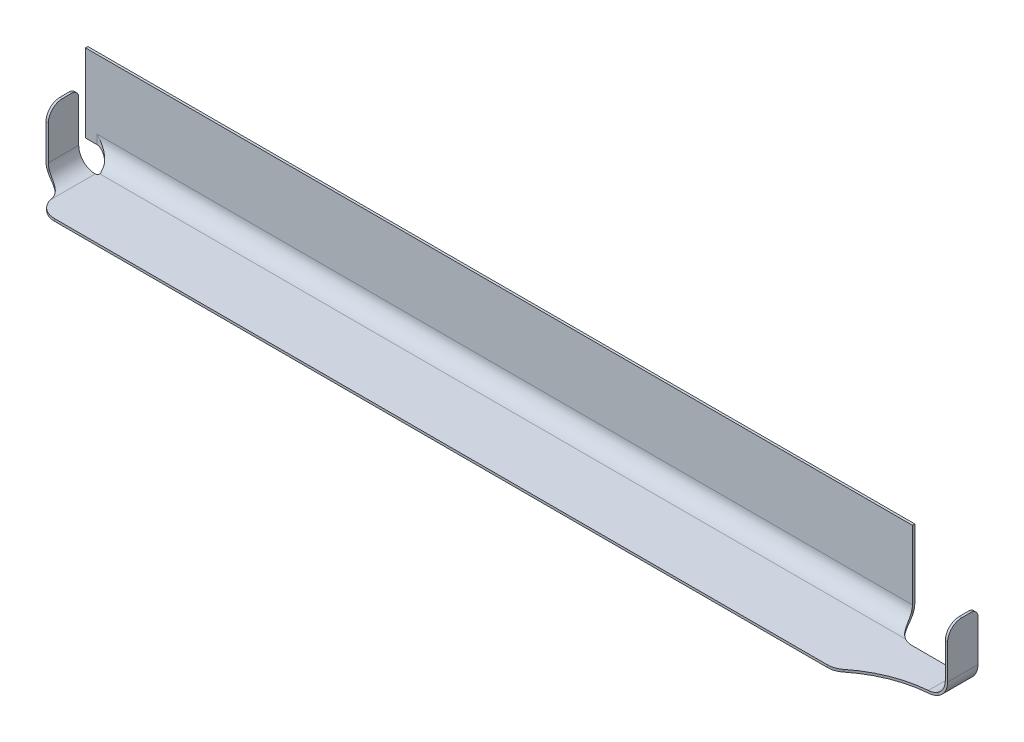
SolidWorks part; units mm, degrees
ref_plane "Front Plane" through (0, 0, 0) normal (1, 0, 0) x (0, 1, 0)
ref_plane "Top Plane" through (0, 0, 0) normal (0, 0, 1) x (0, 1, 0)
ref_plane "Right Plane" through (0, 0, 0) normal (0, 1, 0) x (-1, 0, 0)
sketch "sk 5dia hole pat" plane through (0, 0, 0) normal (0, 0, 1) x (0, 1, 0)
  line L4 (-30.48, -48.26) -> (30.48, -48.26) construction
  point P3 (0, -48.26)
  circle B0 centre (30.48, -579.12) radius 4.826
  circle B1 centre (1188.72, 579.12) radius 4.826
  circle B2 centre (78.74, -579.12) radius 4.826
  circle B3 centre (127, -579.12) radius 4.826
  circle B4 centre (175.26, -579.12) radius 4.826
  circle B5 centre (223.52, -579.12) radius 4.826
  circle B6 centre (271.78, -579.12) radius 4.826
  circle B7 centre (320.04, -579.12) radius 4.826
  circle B8 centre (368.3, -579.12) radius 4.826
  circle B9 centre (416.56, -579.12) radius 4.826
  circle B10 centre (464.82, -579.12) radius 4.826
  circle B11 centre (513.08, -579.12) radius 4.826
  circle B12 centre (561.34, -579.12) radius 4.826
  circle B13 centre (609.6, -579.12) radius 4.826
  circle B14 centre (657.86, -579.12) radius 4.826
  circle B15 centre (706.12, -579.12) radius 4.826
  circle B16 centre (754.38, -579.12) radius 4.826
  circle B17 centre (802.64, -579.12) radius 4.826
  circle B18 centre (850.9, -579.12) radius 4.826
  circle B19 centre (899.16, -579.12) radius 4.826
  circle B20 centre (947.42, -579.12) radius 4.826
  circle B21 centre (995.68, -579.12) radius 4.826
  circle B22 centre (1043.94, -579.12) radius 4.826
  circle B23 centre (1092.2, -579.12) radius 4.826
  circle B24 centre (1140.46, -579.12) radius 4.826
  circle B25 centre (1188.72, -579.12) radius 4.826
  circle B26 centre (30.48, -530.86) radius 4.826
  circle B27 centre (30.48, -482.6) radius 4.826
  circle B28 centre (30.48, -434.34) radius 4.826
  circle B29 centre (30.48, -386.08) radius 4.826
  circle B30 centre (30.48, -337.82) radius 4.826
  circle B31 centre (30.48, -289.56) radius 4.826
  circle B32 centre (30.48, -241.3) radius 4.826
  circle B33 centre (30.48, -193.04) radius 4.826
  circle B34 centre (30.48, -144.78) radius 4.826
  circle B35 centre (30.48, -96.52) radius 4.826
  circle B36 centre (30.48, -48.26) radius 4.826
  circle B37 centre (30.48, 0) radius 4.826
  circle B38 centre (30.48, 48.26) radius 4.826
  circle B39 centre (30.48, 96.52) radius 4.826
  circle B40 centre (30.48, 144.78) radius 4.826
  circle B41 centre (30.48, 193.04) radius 4.826
  circle B42 centre (30.48, 241.3) radius 4.826
  circle B43 centre (30.48, 289.56) radius 4.826
  circle B44 centre (30.48, 337.82) radius 4.826
  circle B45 centre (30.48, 386.08) radius 4.826
  circle B46 centre (30.48, 434.34) radius 4.826
  circle B47 centre (30.48, 482.6) radius 4.826
  circle B48 centre (30.48, 530.86) radius 4.826
  circle B49 centre (30.48, 579.12) radius 4.826
  circle B50 centre (1140.46, 579.12) radius 4.826
  circle B51 centre (1092.2, 579.12) radius 4.826
  circle B52 centre (1043.94, 579.12) radius 4.826
  circle B53 centre (995.68, 579.12) radius 4.826
  circle B54 centre (947.42, 579.12) radius 4.826
  circle B55 centre (899.16, 579.12) radius 4.826
  circle B56 centre (850.9, 579.12) radius 4.826
  circle B57 centre (802.64, 579.12) radius 4.826
  circle B58 centre (754.38, 579.12) radius 4.826
  circle B59 centre (706.12, 579.12) radius 4.826
  circle B60 centre (657.86, 579.12) radius 4.826
  circle B61 centre (609.6, 579.12) radius 4.826
  circle B62 centre (561.34, 579.12) radius 4.826
  circle B63 centre (513.08, 579.12) radius 4.826
  circle B64 centre (464.82, 579.12) radius 4.826
  circle B65 centre (416.56, 579.12) radius 4.826
  circle B66 centre (368.3, 579.12) radius 4.826
  circle B67 centre (320.04, 579.12) radius 4.826
  circle B68 centre (271.78, 579.12) radius 4.826
  circle B69 centre (223.52, 579.12) radius 4.826
  circle B70 centre (175.26, 579.12) radius 4.826
  circle B71 centre (127, 579.12) radius 4.826
  circle B72 centre (78.74, 579.12) radius 4.826
  circle B73 centre (1188.72, 530.86) radius 4.826
  circle B74 centre (1188.72, 482.6) radius 4.826
  circle B75 centre (1188.72, 434.34) radius 4.826
  circle B76 centre (1188.72, 386.08) radius 4.826
  circle B77 centre (1188.72, 337.82) radius 4.826
  circle B78 centre (1188.72, 289.56) radius 4.826
  circle B79 centre (1188.72, 241.3) radius 4.826
  circle B80 centre (1188.72, 193.04) radius 4.826
  circle B81 centre (1188.72, 144.78) radius 4.826
  circle B82 centre (1188.72, 96.52) radius 4.826
  circle B83 centre (1188.72, 48.26) radius 4.826
  circle B84 centre (1188.72, 0) radius 4.826
  circle B85 centre (1188.72, -48.26) radius 4.826
  circle B86 centre (1188.72, -96.52) radius 4.826
  circle B87 centre (1188.72, -144.78) radius 4.826
  circle B88 centre (1188.72, -193.04) radius 4.826
  circle B89 centre (1188.72, -241.3) radius 4.826
  circle B90 centre (1188.72, -289.56) radius 4.826
  circle B91 centre (1188.72, -337.82) radius 4.826
  circle B92 centre (1188.72, -386.08) radius 4.826
  circle B93 centre (1188.72, -434.34) radius 4.826
  circle B94 centre (1188.72, -482.6) radius 4.826
  circle B95 centre (1188.72, -530.86) radius 4.826
  line B96 (609.6, -579.12) -> (609.6, -504.12) construction
  line B97 (30.48, 0) -> (105.48, 0) construction
  circle B98 centre (-30.48, 579.12) radius 4.826
  circle B99 centre (-175.26, -579.12) radius 4.826
  circle B100 centre (-30.48, -579.12) radius 4.826
  circle B101 centre (-78.74, 579.12) radius 4.826
  circle B102 centre (-127, 579.12) radius 4.826
  circle B103 centre (-175.26, 579.12) radius 4.826
  circle B104 centre (-464.82, 579.12) radius 4.826
  circle B105 centre (-706.12, 579.12) radius 4.826
  circle B106 centre (-754.38, 579.12) radius 4.826
  circle B107 centre (-802.64, 579.12) radius 4.826
  circle B108 centre (-899.16, 579.12) radius 4.826
  circle B109 centre (-30.48, 530.86) radius 4.826
  circle B110 centre (-30.48, 482.6) radius 4.826
  circle B111 centre (-30.48, 434.34) radius 4.826
  circle B112 centre (-30.48, 386.08) radius 4.826
  circle B113 centre (-30.48, 337.82) radius 4.826
  circle B114 centre (-30.48, 289.56) radius 4.826
  circle B115 centre (-30.48, 241.3) radius 4.826
  circle B116 centre (-30.48, 193.04) radius 4.826
  circle B117 centre (-30.48, 144.78) radius 4.826
  circle B118 centre (-30.48, 96.52) radius 4.826
  circle B119 centre (-30.48, 48.26) radius 4.826
  circle B120 centre (-30.48, 0) radius 4.826
  circle B121 centre (-30.48, -48.26) radius 4.826
  circle B122 centre (-30.48, -96.52) radius 4.826
  circle B123 centre (-30.48, -144.78) radius 4.826
  circle B124 centre (-30.48, -241.3) radius 4.826
  circle B125 centre (-30.48, -289.56) radius 4.826
  circle B126 centre (-30.48, -337.82) radius 4.826
  circle B127 centre (-30.48, -386.08) radius 4.826
  circle B128 centre (-30.48, -434.34) radius 4.826
  circle B129 centre (-30.48, -482.6) radius 4.826
  circle B130 centre (-30.48, -530.86) radius 4.826
  line B131 (-1188.72, 0) -> (-1113.72, 0) construction
  dimension "D1" = 60.96
sketch_block_instance "5dia hole pat-1"
sketch_block "5dia hole pat" parameters "D1"=9.652, "D2"=9.652, "D3"=75
sketch_block_instance "5dia hole pat-2"
sketch "sk 47.986in pnl" plane through (0, 0, 0) normal (0, 0, 1) x (0, 1, 0)
  line B0 (0.1778, 0) -> (1219.0222, 0) construction
  line B1 (0.1778, 609.4222) -> (1219.0222, 609.4222)
  line B2 (0.1778, 609.4222) -> (0.1778, -609.4222)
  line B3 (0.1778, -609.4222) -> (1219.0222, -609.4222)
  line B4 (1219.0222, 609.4222) -> (1219.0222, -609.4222)
  line B5 (609.6, 609.4222) -> (609.6, -609.4222) construction
  line B6 (-1219.0222, 0) -> (-0.1778, 0) construction
  line B7 (-1219.0222, 609.4222) -> (-0.1778, 609.4222)
  line B8 (-1219.0222, 609.4222) -> (-1219.0222, -609.4222)
  line B9 (-1219.0222, -609.4222) -> (-0.1778, -609.4222)
  line B10 (-0.1778, 609.4222) -> (-0.1778, -609.4222)
  line B11 (-609.6, 609.4222) -> (-609.6, -609.4222) construction
  dimension "D1" = 30.3022
  dimension "D2" = 30.3022
sketch_block_instance "47.986in pnl-1"
sketch_block "47.986in pnl" parameters "D1"=1218.8444, "D2"=1218.8444
sketch_block_instance "47.986in pnl-2"
sketch "sk Main Body" plane through (0, 0, 0) normal (1, 0, 0) x (0, 1, 0)
  line L0 (49.53, 0) -> (-43.18, 0)
  line L1 (-68.58, 25.4) -> (-68.58, 107.95)
  line L2 (49.53, 3.175) -> (-43.18, 3.175)
  line L3 (-65.405, 25.4) -> (-65.405, 107.95)
  line L4 (-68.58, 107.95) -> (-65.405, 107.95)
  line L5 (49.53, 0) -> (49.53, 3.175)
  line L6 (670.3644, 0) -> (-670.3644, 0) construction
  arc A0 (-43.18, 0) -> (-68.58, 25.4) centre (-43.18, 25.4) cw
  arc A1 (-43.18, 3.175) -> (-65.405, 25.4) centre (-43.18, 25.4) cw
  dimension "D2" = 25.4
  dimension "D1" = 19.05
  dimension "D3" = 12.7
  dimension "D5" = 82.55
  dimension "D4" = 3.175
extrude "Main Body" add sketch "sk Main Body" along normal mid plane 1218.8444
sketch "sk Vert Rib Body" plane through (0, 0, 0) normal (0, 1, 0) x (-1, 0, 0)
  line L3 (55, 0) -> (-55, 0) construction
  line L10 (-609.4222, 3.175) -> (609.4222, 3.175) construction
  point P3 (-560.07, 1.5875)
  point P7 (554.1233, 3.175)
  point P11 (554.1233, 3.175)
  line B0 (-560.07, 0) -> (-652.78, 0)
  line B1 (-678.18, 25.4) -> (-678.18, 158.75)
  line B2 (-652.78, 184.15) -> (-617.22, 184.15)
  line B3 (-636.27, 213.8401) -> (-636.27, 147.2198) construction
  line B4 (-560.07, 3.175) -> (-652.78, 3.175)
  line B5 (-675.005, 25.4) -> (-675.005, 158.75)
  line B6 (-652.78, 180.975) -> (-617.22, 180.975)
  line B7 (-617.22, 184.15) -> (-617.22, 180.975)
  line B8 (-560.07, 3.175) -> (-560.07, 0)
  arc B9 (-652.78, 0) -> (-678.18, 25.4) centre (-652.78, 25.4) cw
  arc B10 (-678.18, 158.75) -> (-652.78, 184.15) centre (-652.78, 158.75) cw
  arc B11 (-652.78, 3.175) -> (-675.005, 25.4) centre (-652.78, 25.4) cw
  arc B12 (-675.005, 158.75) -> (-652.78, 180.975) centre (-652.78, 158.75) cw
  line B13 (659.13, 0) -> (566.42, 0)
  line B14 (541.02, 25.4) -> (541.02, 158.75)
  line B15 (659.13, 3.175) -> (566.42, 3.175)
  line B16 (544.195, 25.4) -> (544.195, 158.75)
  line B17 (659.13, 3.175) -> (659.13, 0)
  arc B18 (566.42, 0) -> (541.02, 25.4) centre (566.42, 25.4) cw
  arc B19 (541.02, 158.75) -> (566.42, 184.15) centre (566.42, 158.75) cw
  arc B20 (566.42, 3.175) -> (544.195, 25.4) centre (566.42, 25.4) cw
  dimension "D2" = 19.05
  dimension "D1" = 12.7
sketch_block_instance "Vert Rib Body-1"
sketch_block "Vert Rib Body" parameters "D1"=25.4, "D2"=16.51, "D3"=19.05, "D4"=177.8
sketch_block_instance "Vert Rib Body-2"
sketch "Interferance" plane through (0, 0, 0) normal (0, 0, 1) x (0, 1, 0)
  line L0 (0.1778, 609.4222) -> (1219.0222, 609.4222) construction
  line L1 (-68.58, 541.02) -> (-46.1715, 541.02)
  line L2 (-68.58, 541.02) -> (-68.58, 609.4222)
  line L3 (-68.58, 609.4222) -> (-46.1715, 609.4222)
  line L4 (-46.1715, 541.02) -> (-46.1715, 609.4222)
  line L8 (-68.58, -609.4222) -> (-68.58, 609.4222) construction
  line L9 (0.1778, -609.4222) -> (1219.0222, -609.4222) construction
  line L10 (-68.58, -609.4222) -> (49.53, -609.4222)
  line L11 (-68.58, -609.4222) -> (-68.58, -560.07)
  line L12 (-68.58, -560.07) -> (49.53, -560.07)
  line L13 (49.53, -609.4222) -> (49.53, -560.07)
  line L14 (49.53, -609.4222) -> (49.53, 609.4222) construction
  line L20 (-46.1715, 554.1233) -> (68.9891, 554.1233)
  dimension "D1" = 68.4022
  dimension "D2" = 49.3522
  dimension "D3" = 55.2989
sketch "sk lateral cut" plane through (0, 0, 0) normal (0, 1, 0) x (-1, 0, 0)
  line L0 (541.02, 25.4) -> (541.02, 158.75) construction
  line L1 (620.2848, 124.072) -> (540.766, 124.072)
  line L2 (620.2848, 124.072) -> (620.2848, 3.175)
  line L3 (620.2848, 3.175) -> (514.0325, 3.175)
  line L4 (540.766, 124.072) -> (540.766, 43.7253) construction
  line L5 (514.0325, 124.072) -> (514.0325, 3.175)
  line L6 (-609.4222, 3.175) -> (609.4222, 3.175) construction
  line L7 (514.0325, 124.072) -> (540.766, 124.072)
  dimension "D1" = 0.254
  dimension "D3" = 26.7335
extrude " Lateral cut" cut sketch "sk lateral cut" against normal through all
sketch "Sketch4" plane through (0, 0, 0) normal (0, 0, 1) x (0, 1, 0)
  line L0 (-68.58, -560.07) -> (49.53, -560.07) construction
  line L1 (-94.7483, -559.816) -> (63.9754, -559.816)
  line L2 (-94.7483, -559.816) -> (-94.7483, -630.9346)
  line L3 (-94.7483, -630.9346) -> (63.9754, -630.9346)
  line L4 (63.9754, -559.816) -> (63.9754, -630.9346)
  line L10 (-77.8228, 552.5358) -> (63.9754, 552.5358)
  line L11 (-46.1715, 554.1233) -> (68.9891, 554.1233) construction
  line L12 (-77.8228, 552.5358) -> (-77.8228, 644.2383)
  line L13 (-77.8228, 644.2383) -> (63.9754, 644.2383)
  line L14 (63.9754, 644.2383) -> (63.9754, 552.5358)
  dimension "D1" = 0.254
  dimension "D2" = 1.5875
extrude "Up Dwn cut" cut sketch "Sketch4" along normal through all
ref_plane "Tab lower pln" through (0, 0, 25.4) normal (0, 0, 1) x (0, 1, 0)
ref_plane "Left tab pln" through (673.4175, 0, 0) normal (1, 0, 0) x (0, 1, 0)
ref_plane "Right tab pln" through (-539.4325, 0, 0) normal (1, 0, 0) x (0, 1, 0)
sketch "Sketch5" plane through (0, 0, 25.4) normal (0, 0, 1) x (0, 1, 0)
  line L0 (-68.58, -557.816) -> (-68.58, -648.0175)
  line L1 (-43.18, -673.4175) -> (22.3, -673.4175)
  line L2 (-65.405, -557.816) -> (-65.405, -648.0175)
  line L3 (-43.18, -670.2425) -> (22.3, -670.2425)
  line L4 (-68.58, -557.816) -> (-65.405, -557.816)
  line L5 (22.3, -673.4175) -> (22.3, -670.2425)
  line L6 (-68.58, -559.816) -> (-68.58, 514.0325) construction
  line L7 (-65.405, -559.816) -> (-68.58, -559.816) construction
  line L8 (-64.9605, -673.4175) -> (64.9605, -673.4175) construction
  line L9 (22.3, 539.4325) -> (-43.18, 539.4325)
  line L10 (-68.58, 514.0325) -> (-68.58, 509.0325)
  line L11 (22.3, 536.2575) -> (-43.18, 536.2575)
  line L12 (-65.405, 514.0325) -> (-65.405, 509.0325)
  line L13 (22.3, 539.4325) -> (22.3, 536.2575)
  line L14 (-65.405, 509.0325) -> (-68.58, 509.0325)
  line L15 (-64.9605, 539.4325) -> (64.9605, 539.4325) construction
  arc A0 (-68.58, -648.0175) -> (-43.18, -673.4175) centre (-43.18, -648.0175) ccw
  arc A1 (-65.405, -648.0175) -> (-43.18, -670.2425) centre (-43.18, -648.0175) ccw
  arc A2 (-43.18, 539.4325) -> (-68.58, 514.0325) centre (-43.18, 514.0325) ccw
  arc A3 (-43.18, 536.2575) -> (-65.405, 514.0325) centre (-43.18, 514.0325) ccw
  dimension "D1" = 25.4
  dimension "D5" = 25.4
  dimension "D3" = 2
  dimension "D4" = 87.705
  dimension "D7" = 87.705
  dimension "D8" = 5
  dimension "D2" = 3.175
  dimension "D6" = 3.175
extrude "Tab Main bdy" add sketch "Sketch5" along normal blind 44
sketch "Sketch8" plane through (0, 0, 0) normal (0, 1, 0) x (-1, 0, 0)
  line L0 (514.0325, 25.4) -> (572.9376, 25.4) construction
  line L1 (514.0325, 28.575) -> (572.9376, 28.575)
  line L2 (514.0325, 22.225) -> (572.9376, 22.225)
  line L3 (-559.816, 25.4) -> (514.0325, 25.4) construction
  line L4 (514.0325, 25.4) -> (514.0325, 69.4) construction
  line L5 (-559.816, 25.4) -> (-559.816, 3.175) construction
  line L6 (-696.7859, 28.575) -> (-559.816, 28.575)
  line L7 (-696.7859, 28.575) -> (-696.7859, 5.0296)
  line L8 (-696.7859, 5.0296) -> (-559.816, 5.0296)
  line L9 (-559.816, 28.575) -> (-559.816, 5.0296)
  arc A0 (514.0325, 28.575) -> (514.0325, 22.225) centre (514.0325, 25.4) ccw
  arc A1 (572.9376, 22.225) -> (572.9376, 28.575) centre (572.9376, 25.4) ccw
  point P2 (543.485, 25.4)
  dimension "D1" = 3.175
extrude "Tab undercut" cut sketch "Sketch8" against normal through all both and the other way through all
fillet "Fillet2" radius 12.2 1 edges at (-514.0325, -66.7789, 22.225)
fillet "Fillet3" radius 25.4 1 edges at (-514.0325, -49.3284, 3.175)
fillet "Fillet4" radius 150 1 edges at (559.816, -66.9925, 69.4)
fillet "Fillet5" radius 22 1 edges at (-514.0325, -66.9925, 69.4)
fillet "Fillet6" radius 25.4 3 edges at (559.816, -66.9925, 107.95) (-514.0325, -66.9925, 107.95) (559.816, -66.9925, 28.575)
fillet "Fillet7" radius 19.05 2 edges at (-537.845, 22.3, 69.4) (671.83, 22.3, 69.4)
fillet "Fillet8" radius 9.525 2 edges at (671.83, 22.3, 28.575) (-537.845, 22.3, 28.575)
sketch "Sketch6" plane through (0, 0, 0) normal (1, 0, 0) x (0, 1, 0)
  line L0 (64.9605, 25.4) -> (-64.9605, 25.4) construction
  line L1 (0, -59.3725) -> (0, 59.3725) construction
  circle A0 centre (0, 59.397) radius 10 construction
  circle A1 centre (12.7, 37.4) radius 10 construction
  circle A2 centre (-12.7, 37.4) radius 10 construction
  line B0 (12.7, 37.4) -> (-12.7, 37.4) construction
  circle B1 centre (-12.7, 37.4) radius 2.5908
  circle B2 centre (12.7, 37.4) radius 2.5908
  circle B3 centre (0, 59.397) radius 2.5908
  line B4 (0, 37.4) -> (0, 44.7323) construction
  dimension "D2" = 20
  dimension "D3" = 20
  dimension "D4" = 20
  dimension "D1" = 12
sketch_block_instance "Blind Rivet holes-1"
sketch_block "Blind Rivet holes" parameters "D1"=5.1816, "D2"=5.1816, "D3"=5.1816, "D4"=60, "D5"=60, "D6"=25.4, "D7"=25.4, "D8"=25.4
sketch "Sketch9" plane through (0, 0, 0) normal (0, 0, 1) x (0, 1, 0)
  circle A0 centre (-30.48, -530.86) radius 4.826
  circle A1 centre (30.48, -530.86) radius 4.826
  circle A2 centre (-30.48, -530.86) radius 4.826 construction
  circle A3 centre (30.48, -530.86) radius 4.826 construction
  circle A4 centre (-30.48, -482.6) radius 4.826
  circle A5 centre (30.48, -482.6) radius 4.826
  circle A6 centre (-30.48, -434.34) radius 4.826
  circle A7 centre (30.48, -434.34) radius 4.826
  circle A8 centre (-30.48, -386.08) radius 4.826
  circle A9 centre (30.48, -386.08) radius 4.826
  circle A10 centre (-30.48, -337.82) radius 4.826
  circle A11 centre (30.48, -337.82) radius 4.826
  circle A12 centre (-30.48, -289.56) radius 4.826
  circle A13 centre (30.48, -289.56) radius 4.826
  circle A14 centre (-30.48, -241.3) radius 4.826
  circle A15 centre (30.48, -241.3) radius 4.826
  circle A16 centre (-30.48, -193.04) radius 4.826
  circle A17 centre (30.48, -193.04) radius 4.826
  circle A18 centre (-30.48, -144.78) radius 4.826
  circle A19 centre (30.48, -144.78) radius 4.826
  circle A20 centre (-30.48, -96.52) radius 4.826
  circle A21 centre (30.48, -96.52) radius 4.826
  circle A22 centre (-30.48, -48.26) radius 4.826
  circle A23 centre (30.48, -48.26) radius 4.826
  circle A24 centre (-30.48, 0) radius 4.826
  circle A25 centre (30.48, 0) radius 4.826
  circle A26 centre (-30.48, 48.26) radius 4.826
  circle A27 centre (30.48, 48.26) radius 4.826
  circle A28 centre (-30.48, 96.52) radius 4.826
  circle A29 centre (30.48, 96.52) radius 4.826
  circle A30 centre (-30.48, 144.78) radius 4.826
  circle A31 centre (30.48, 144.78) radius 4.826
  circle A32 centre (-30.48, 193.04) radius 4.826
  circle A33 centre (30.48, 193.04) radius 4.826
  circle A34 centre (-30.48, 241.3) radius 4.826
  circle A35 centre (30.48, 241.3) radius 4.826
  circle A36 centre (-30.48, 289.56) radius 4.826
  circle A37 centre (30.48, 289.56) radius 4.826
  circle A38 centre (-30.48, 337.82) radius 4.826
  circle A39 centre (30.48, 337.82) radius 4.826
  circle A40 centre (-30.48, 386.08) radius 4.826
  circle A41 centre (30.48, 386.08) radius 4.826
  circle A42 centre (-30.48, 434.34) radius 4.826
  circle A43 centre (30.48, 434.34) radius 4.826
  circle A44 centre (-30.48, 482.6) radius 4.826
  circle A45 centre (30.48, 482.6) radius 4.826
  circle A46 centre (-30.48, 530.86) radius 4.826
  circle A47 centre (30.48, 530.86) radius 4.826
  dimension "D1" = 23
extrude "Base holes" [suppressed] cut sketch "Sketch9" along normal blind 10
extrude "cut Rivet" [suppressed] cut sketch "Sketch6" against normal through all both and the other way through all
sketch "Sketch10" [suppressed] plane through (0, 0, 0) normal (0, 0, 1) x (0, 1, 0)
  line L0 (-0.1778, 609.4222) -> (-0.1778, -609.4222) construction
  line L1 (-0.1778, 554.9718) -> (184.2643, 554.9718)
  line L2 (-0.1778, 554.9718) -> (-0.1778, -580.5661)
  line L3 (-0.1778, -580.5661) -> (184.2643, -580.5661)
  line L4 (184.2643, 554.9718) -> (184.2643, -580.5661)
extrude "Cut-Extrude1" [suppressed] cut sketch "Sketch10" along normal blind 10
equation "\"3i\"=138.375"
equation "\".75i\"=12.7"
